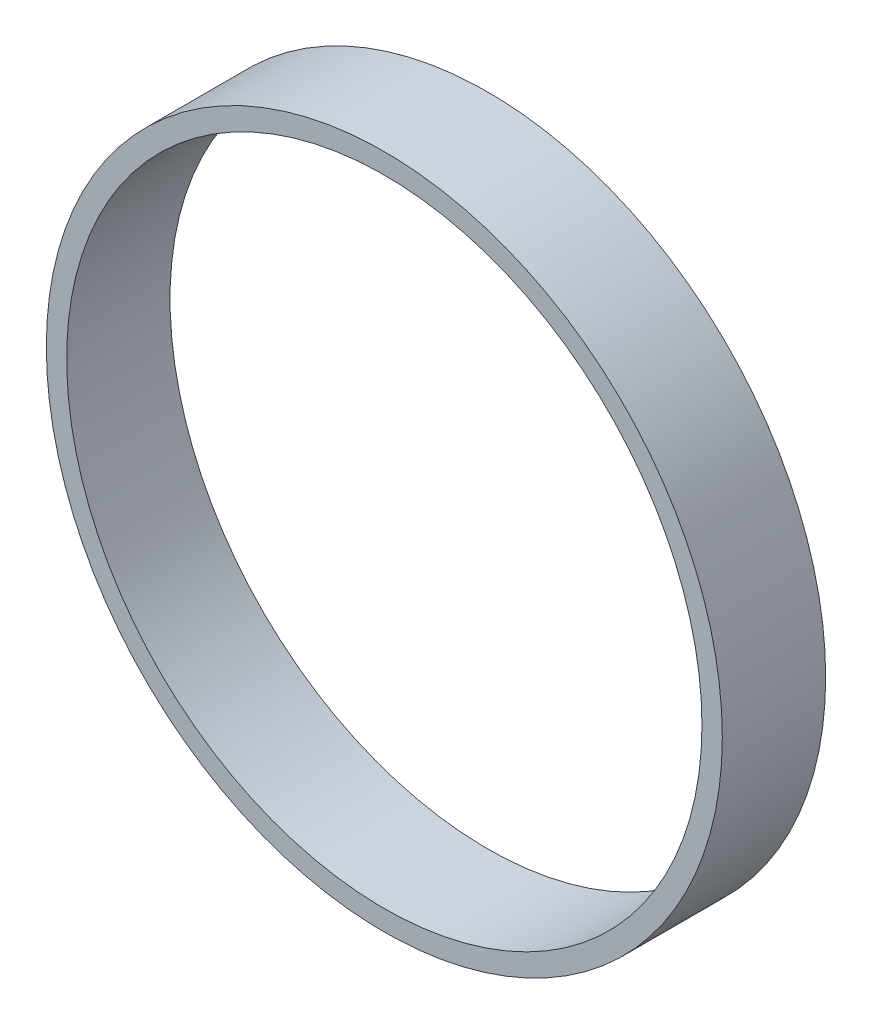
SolidWorks part; units mm, degrees
ref_plane "Front Plane" through (0, 0, 0) normal (0, 0, 1) x (1, 0, 0)
ref_plane "Top Plane" through (0, 0, 0) normal (0, 1, 0) x (1, 0, 0)
ref_plane "Right Plane" through (0, 0, 0) normal (1, 0, 0) x (0, 0, -1)
other "Configuration Table"
sketch "Sketch1" plane through (0, 0, 0) normal (0, 0, 1) x (1, 0, 0)
  circle A0 centre (0, 0) radius 78.05
  circle A1 centre (0, 0) radius 83.05
  dimension "Out_dia" = 166.1
  dimension "Thickness" = 5
extrude "BasePipe" add sketch "Sketch1" along normal mid plane 25.4
